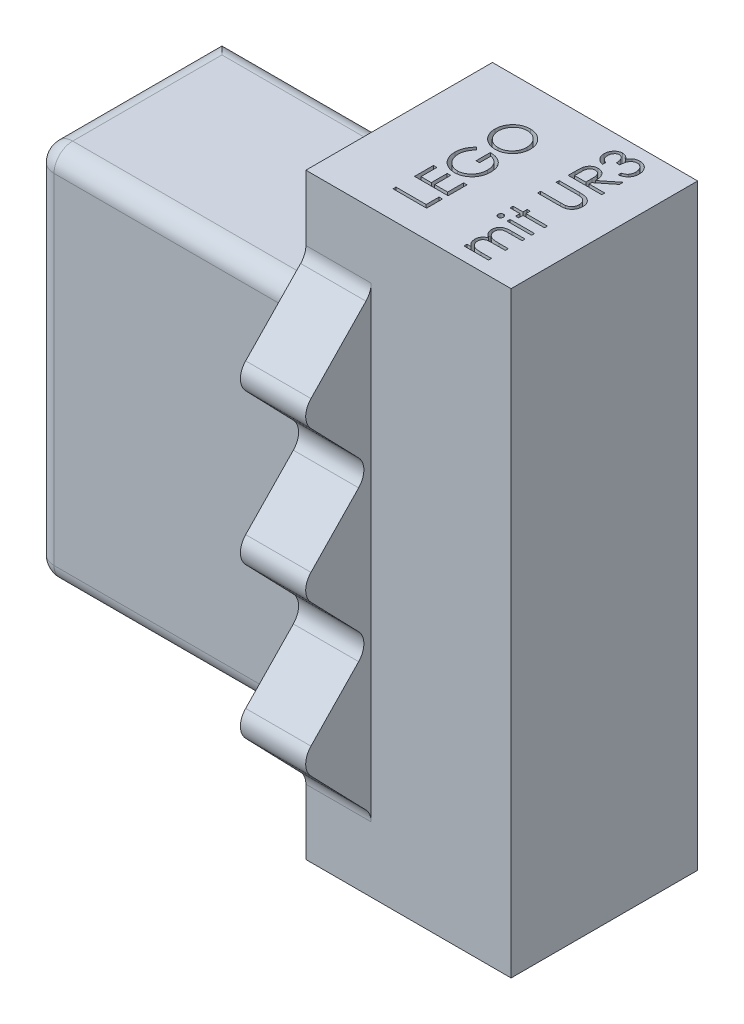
SolidWorks part; units mm, degrees
ref_plane "Ebene vorne" through (0, 0, 0) normal (0, 0, 1) x (1, 0, 0)
ref_plane "Ebene oben" through (0, 0, 0) normal (0, 1, 0) x (1, 0, 0)
ref_plane "Ebene rechts" through (0, 0, 0) normal (1, 0, 0) x (0, 0, -1)
sketch "Skizze1" plane through (0, 0, 0) normal (0, 0, 1) x (1, 0, 0)
  line L0 (14.5, 20.2) -> (14.5, 0)
  line L1 (0, 0) -> (14.5, 0)
  line L2 (0, 0) -> (0, 20.2)
  line L3 (0, 20.2) -> (14.5, 20.2)
  dimension "D1" = 14.5
  dimension "D2" = 20.2
extrude "Aufsatz-Linear austragen1" add sketch "Skizze1" along normal blind 10
sketch "Skizze11" plane through (0, 0, 10) normal (0, 0, 1) x (1, 0, 0)
  line L5 (14.5, 0) -> (14.5, 20.2) construction
  line L6 (14.5, 26.1) -> (25.5, 26.1)
  line L7 (14.5, 26.1) -> (14.5, -5.9)
  line L8 (14.5, -5.9) -> (25.5, -5.9)
  line L9 (25.5, 26.1) -> (25.5, -5.9)
  point P5 (14.5, 10.1)
  point P6 (14.5, 10.1)
  dimension "D1" = 32
  dimension "D2" = 11
extrude "Aufsatz-Linear austragen9" add sketch "Skizze11" against normal up to surface (10 mm away)
sketch "Skizze3" plane through (0, 0, 0) normal (0, 0, -1) x (-1, 0, 0)
  line L0 (0, 20.2) -> (0, 0) construction
  line L1 (0, 4.15) -> (-18.35, 4.15)
  line L2 (0, 4.15) -> (0, 16.05)
  line L3 (0, 16.05) -> (-18.35, 16.05)
  line L4 (-18.35, 4.15) -> (-18.35, 16.05)
  line L5 (0, 0) -> (0, 20.2) construction
  arc A0 (-18.35, 16.05) -> (-18.35, 4.15) centre (-18.35, 10.1) ccw
  point P10 (0, 10.1)
  point P11 (0, 10.1)
  point P14 (-24.3, 10.1)
  dimension "D1" = 24.3
  dimension "D2" = 11.9
extrude "Schnitt-Linear austragen2" cut sketch "Skizze3" against normal blind 7.3 contours L4 L1 L3 M5 | L4 A0
sketch "Skizze5" plane through (0, 4.15, 0) normal (0, 1, 0) x (1, 0, 0)
  line L0 (0, -7.3) -> (0, 0) construction
  line L1 (0, -2.3) -> (18.35, -2.3)
  line L2 (0, -2.3) -> (0, -5)
  line L3 (0, -5) -> (18.35, -5)
  line L4 (18.35, -2.3) -> (18.35, -5)
  line L5 (18.35, -7.3) -> (18.35, 0) construction
  line L7 (0, -7.3) -> (0, 0) construction
  point P12 (0, -3.65)
  point P13 (0, -3.65)
  dimension "D1" = 2.7
extrude "Aufsatz-Linear austragen3" add sketch "Skizze5" along normal blind 1.7
sketch "Skizze6" plane through (0, 16.05, 0) normal (0, -1, 0) x (1, 0, 0)
  line L0 (0, 7.3) -> (0, 0) construction
  line L1 (0, 2.3) -> (18.35, 2.3)
  line L2 (0, 2.3) -> (0, 5)
  line L3 (0, 5) -> (18.35, 5)
  line L4 (18.35, 2.3) -> (18.35, 5)
  line L5 (18.35, 7.3) -> (18.35, 0) construction
  line L7 (0, 7.3) -> (0, 0) construction
  point P12 (0, 3.65)
  point P13 (0, 3.65)
  dimension "D1" = 2.7
extrude "Aufsatz-Linear austragen4" add sketch "Skizze6" along normal blind 1.7
sketch "Skizze9" plane through (18.35, 0, 0) normal (1, 0, 0) x (0, 0, -1)
  line L1 (-2.3, 14.35) -> (-5, 14.35)
  line L2 (-2.3, 14.35) -> (-2.3, 16.05)
  line L3 (-2.3, 16.05) -> (-5, 16.05)
  line L4 (-5, 14.35) -> (-5, 16.05)
extrude "Aufsatz-Linear austragen5" add sketch "Skizze9" along normal up to surface (4.1641 mm away)
sketch "Skizze10" plane through (18.35, 0, 0) normal (1, 0, 0) x (0, 0, -1)
  line L1 (-5, 5.85) -> (-2.3, 5.85)
  line L2 (-5, 5.85) -> (-5, 4.15)
  line L3 (-5, 4.15) -> (-2.3, 4.15)
  line L4 (-2.3, 5.85) -> (-2.3, 4.15)
extrude "Aufsatz-Linear austragen7" add sketch "Skizze10" along normal up to surface (4.1641 mm away)
sketch "Skizze13" plane through (14.5, 0, 0) normal (-1, 0, 0) x (0, 0, 1)
  line L2 (10, -2) -> (13.9, 2.0333)
  line L4 (13.9, 2.0333) -> (10, 6.0667)
  line L9 (10, 6.0667) -> (10, -2)
  line L10 (10, -5.9) -> (10, 26.1) construction
  line L12 (10, 10.1) -> (21.2285, 10.1) construction
  line L14 (10, 6.0667) -> (13.9, 10.1)
  line L15 (13.9, 10.1) -> (10, 14.1333)
  line L16 (10, 14.1333) -> (10, 6.0667)
  line L17 (10, 14.1333) -> (13.9, 18.1667)
  line L18 (13.9, 18.1667) -> (10, 22.2)
  line L19 (10, 22.2) -> (10, 14.1333)
  line L20 (10, 20.2) -> (10, 0) construction
  dimension "D1" = 3.9
  dimension "D2" = 3.9
extrude "Aufsatz-Linear austragen10" add sketch "Skizze13" against normal blind 3.5 contours L19 L18 L17 M28 | L16 L15 L14 | L9 L4 L2 | L15 L16 L14 | L18 L19 L17
sketch "Skizze14" plane through (0, 26.1, 0) normal (0, 1, 0) x (-1, 0, 0)
  line L0 (-20, 0) -> (-20, 10) construction
  line L1 (-25.5, 0) -> (-14.5, 0) construction
  line L2 (-14.5, 10) -> (-25.5, 10) construction
  text T0 "LEGO   mit UR3" font "Century Gothic" height 1.8
extrude "Schnitt-Linear austragen3" cut sketch "Skizze14" against normal blind 1
sketch "Skizze15" plane through (0, -5.9, 0) normal (0, -1, 0) x (1, 0, 0)
  line L0 (20, 0) -> (20, 10) construction
  line L1 (14.5, 0) -> (25.5, 0) construction
  line L2 (14.5, 10) -> (25.5, 10) construction
  text T0 "WS  2021/22" font "Century Gothic" height 1.8
extrude "Schnitt-Linear austragen4" cut sketch "Skizze15" against normal blind 1
chamfer "Fase2" distance 1 angle 45 2 edges at (14.5, 20.2, 5) (14.5, 0, 5)
fillet "Verrundung2" radius 1 18 edges at (6.75, 20.2, 0) (6.75, 20.2, 10) (6.75, 0, 0) (6.75, 0, 10) (0, 20.2, 5) (0, 0, 5) (0, 10.1, 10) (14, 20.7, 10) (14, 20.7, 0) (14, -0.5, 10) (14, -0.5, 0) (16.25, 22.2, 10) (16.25, -2, 10) (16.25, 18.1667, 13.9) (16.25, 10.1, 13.9) (16.25, 2.0333, 13.9) (16.25, 14.1333, 10) (16.25, 6.0667, 10)
fillet "Verrundung3" radius 1.35 4 edges at (0, 5, 2.3) (0, 5, 5) (0, 15.2, 2.3) (0, 15.2, 5)
chamfer "Fase3" distance 0.5 angle 60 5 edges at (0, 4.15, 1.825) (0, 4.15, 5.475) (0, 10.1, 7.3) (0, 16.05, 1.825) (0, 16.05, 5.475)
